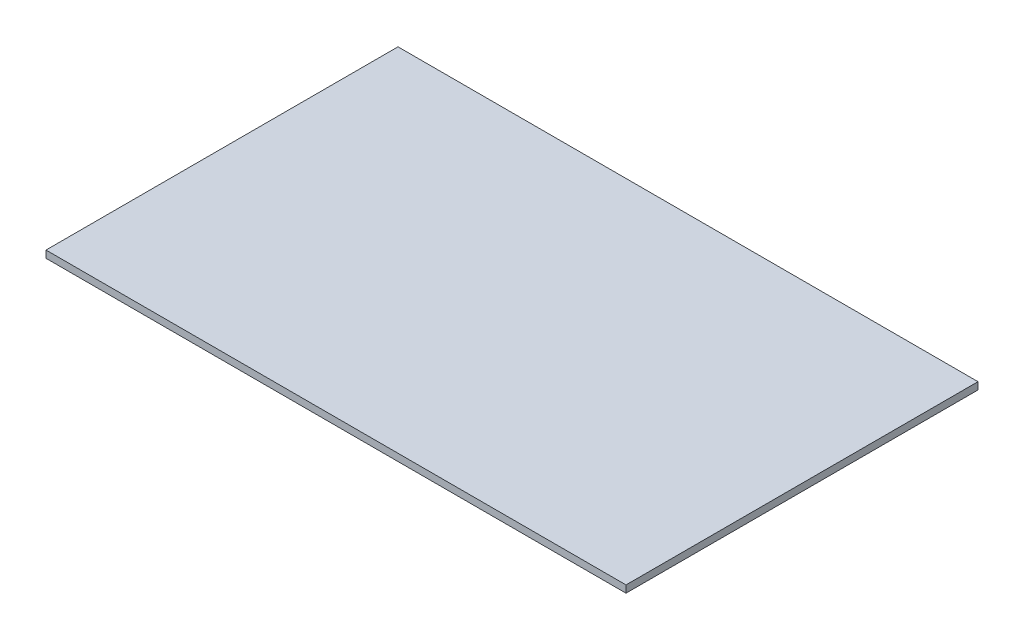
SolidWorks part; units mm, degrees
ref_plane "Front" through (0, 0, 0) normal (0, 0, 1) x (1, 0, 0)
ref_plane "Top" through (0, 0, 0) normal (0, 1, 0) x (1, 0, 0)
ref_plane "Right" through (0, 0, 0) normal (1, 0, 0) x (0, 0, -1)
sketch "Sketch1" plane through (0, 0, 0) normal (0, 1, 0) x (1, 0, 0)
  line L1 (0, 0) -> (1025.398, 0)
  line L2 (0, 0) -> (0, 622.3)
  line L3 (0, 622.3) -> (1025.398, 622.3)
  line L4 (1025.398, 0) -> (1025.398, 622.3)
  dimension "D1" = 1025.398
  dimension "D2" = 622.3
extrude "Extrude1" add sketch "Sketch1" along normal blind 12.7
